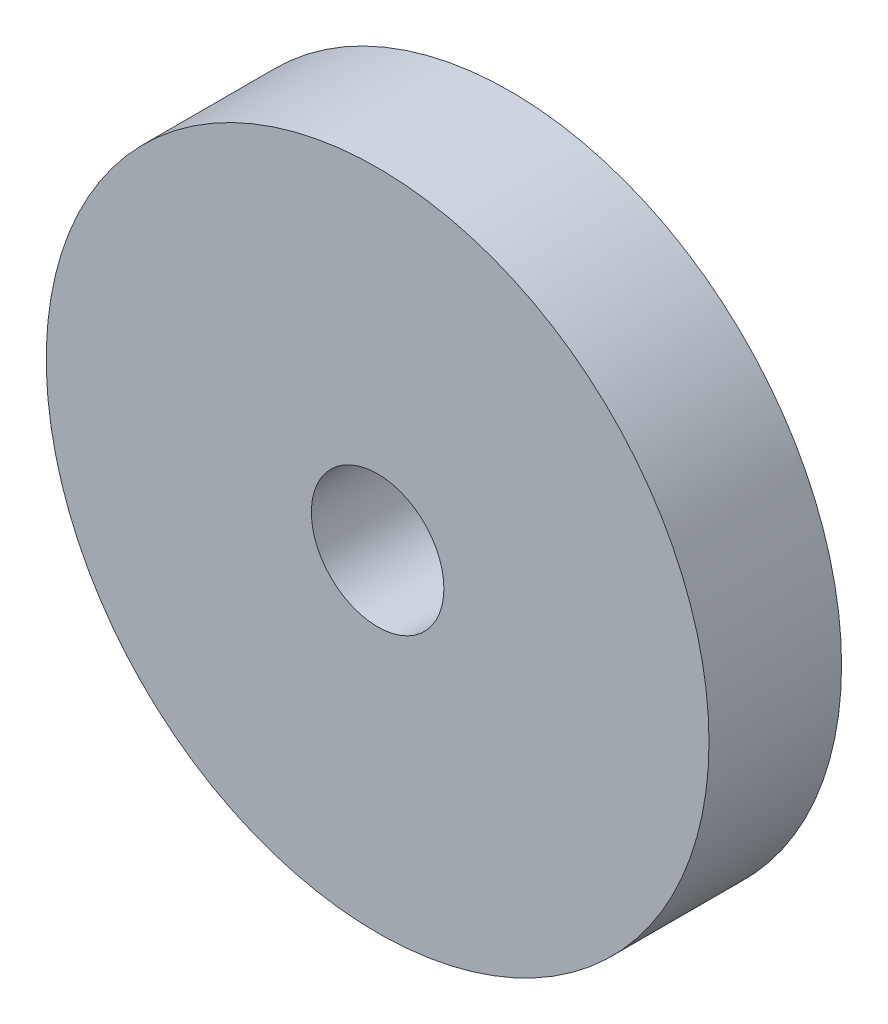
SolidWorks part; units mm, degrees
ref_plane "Plan de face" through (0, 0, 0) normal (0, 0, 1) x (1, 0, 0)
ref_plane "Plan de dessus" through (0, 0, 0) normal (0, 1, 0) x (1, 0, 0)
ref_plane "Plan de droite" through (0, 0, 0) normal (1, 0, 0) x (0, 0, -1)
sketch "Esquisse1" plane through (0, 0, 0) normal (0, 0, 1) x (1, 0, 0)
  line L0 (-31.8773, 0) -> (31.8773, 0) construction
  line L2 (0, 31.8773) -> (0, -30.6288) construction
  circle A0 centre (0, 0) radius 3
  circle A1 centre (0, 0) radius 15
extrude "Extrusion1" add sketch "Esquisse1" along normal blind 6
